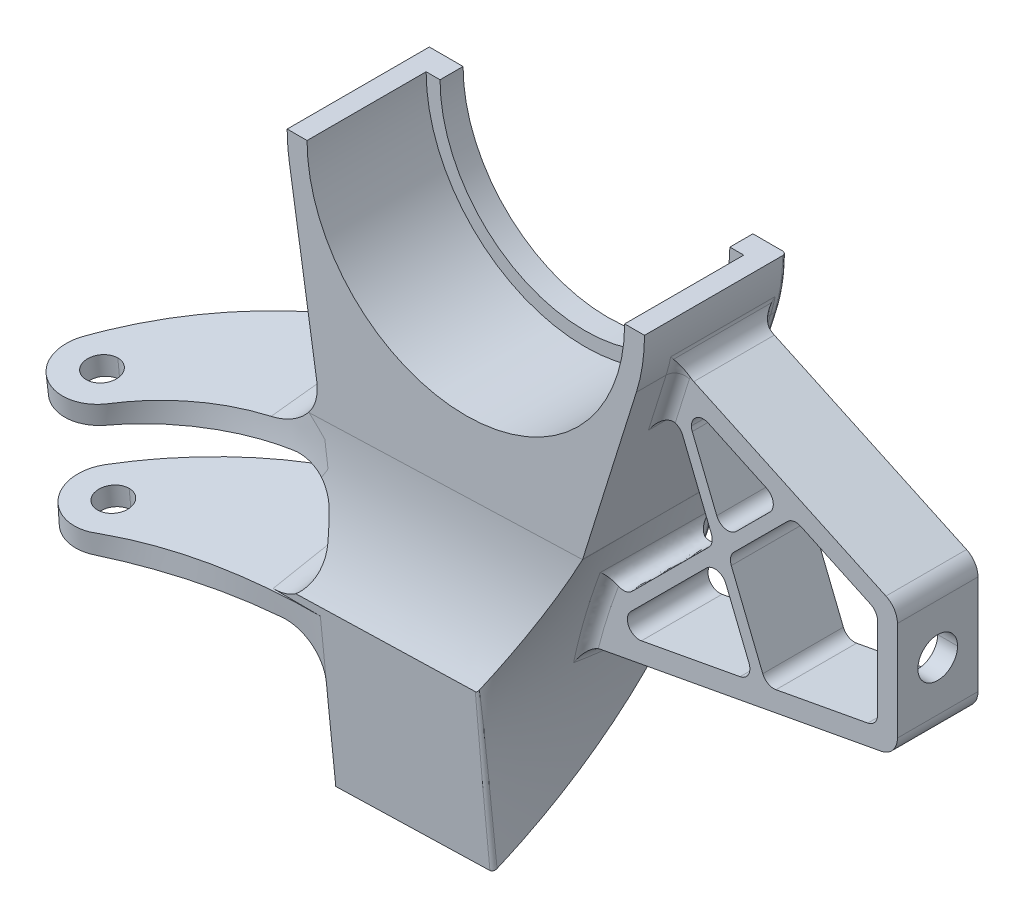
SolidWorks part; units mm, degrees
ref_plane "Ebene vorne" through (0, 0, 0) normal (0, 0, 1) x (1, 0, 0)
ref_plane "Ebene oben" through (0, 0, 0) normal (0, 1, 0) x (1, 0, 0)
ref_plane "Ebene rechts" through (0, 0, 0) normal (1, 0, 0) x (0, 0, -1)
imported_body "Importiert1"
other "Fläche löschen1" [suppressed]
fillet "Verrundung1" [suppressed] radius 30
ref_plane "Ebene1" through (-30.3597, -91.9778, 25.0376) normal (0.1035, -0.0945, 0.9901) x (0.9946, 0.0098, -0.103)
sketch "Skizze1" plane through (-30.3597, -91.9778, 25.0376) normal (0.1035, -0.0945, 0.9901) x (0.9946, 0.0098, -0.103)
  line L0 (-50.7049, 0) -> (0, 0)
  line L1 (-50.7049, 0) -> (0, 0) construction
  line L2 (2.7446, 8.0372) -> (-7.2602, -4.0825)
  arc A0 (-6.9958, -0.6946) -> (-0.1049, 6.8637) centre (-9.9007, 8.8742) ccw construction
  spline S0 degree 3 poles (1699.9889, -889.9636) (21.3325, -654.3805) (17.5656, -326.5526) (-0.0381, 0.7082) (-0.0476, 0.8852) (-17.6849, 328.4814) (-50.0649, 655.1065) (-1702.585, 892.3272) knots -503.335226 -503.335226 -503.335226 -503.335226 0.272589 0.272589 0.545178 0.545178 504.670765 504.670765 504.670765 504.670765 only from (0, 0) to (-0.1049, 1.9484)
  spline S1 degree 3 poles (0, 0) (-0.0095, 0.177) (-0.019, 0.3541) (-0.0381, 0.7082) (-0.0476, 0.8852) (-0.073, 1.3576) (-0.089, 1.653) (-0.1049, 1.9484) knots 0 0 0 0 0.272589 0.272589 0.545178 0.545178 1 1 1 1 construction
  spline S2 degree 3 poles (-1886.469, -621.0381) (2001.1086, 104.5006) (-2015.5402, -16.994) (1875.9916, 652.0051) knots -17.402918 -17.402918 -17.402918 -17.402918 20.424874 20.424874 20.424874 20.424874 only from (-0.1049, 1.9484) to (-4.1842, 25)
  spline S3 degree 3 poles (-0.1049, 1.9484) (-1.122, 9.6877) (-2.5792, 17.3614) (-4.1842, 25) knots 0 0 0 0 1 1 1 1 construction
  dimension "D1" = 10
  dimension "D2" = 3
surface "Oberfläche-Linear austragen1" sketch "Skizze1" parameters "D1"=33.1, "D2"=37.7
other "Fläche ersetzen1"
delete or keep bodies "Körper-Löschen1" type delete bodies bodies 103
fillet "Verrundung3" radius 10 1 edges at (-34.2452, -92.0011, 25.2823)
other "Fläche löschen3"
fillet "Verrundung6" radius 10 1 edges at (-31.006, -87.5296, 23.2494)
sketch "Skizze2" [suppressed] plane through (0, 0, 0) normal (0, 0, -1) x (-1, 0, 0)
  line L0 (8.7548, -110.9323) -> (19.5635, -41.6628)
  line L1 (8.7548, -110.9323) -> (45.0706, -116.599)
  line L2 (19.5635, -41.6628) -> (55.8793, -47.3295)
  line L3 (45.0706, -116.599) -> (55.8793, -47.3295)
  line L4 (44.462, -6.9378) -> (36.3394, -58.9926) construction
  dimension "D1" = 18.8765
  dimension "D2" = 15
  dimension "D3" = 15
extrude "Schnitt-Linear austragen1" [suppressed] cut sketch "Skizze2" against normal through all flip side to cut
sketch3d "3D-Skizze1" [suppressed]
  line L0 (-35.6353, -64.4926, 0.1801) -> (-34.177, -67.948, 36.3964) construction
  line L1 (-35.6353, -64.4926, 0.1801) -> (-34.177, -67.948, 36.3964)
  spline S0 degree 3 poles (-1945.7002, -51.2817, -454.1591) (50.1646, -58.6287, -377.1469) (-44.014, -77.7384, -176.8529) (-30.9602, -96.5352, 20.1612) (-30.7394, -96.8176, 23.1213) (-30.2214, -97.3819, 29.0353) (-29.9255, -97.6638, 31.9899) (-29.3826, -98.0855, 36.4096) (-29.1848, -98.2259, 37.8812) (-19.6136, -104.2289, 100.8003) (31.6775, -109.4405, 155.4245) (1964.085, -85.4365, -96.1608) knots -16.127886 -16.127886 -16.127886 -16.127886 0.25 0.25 0.5 0.5 0.75 0.75 0.875 0.875 6.110281 6.110281 6.110281 6.110281 only from (-31.6783, -95.4044, 8.3089) to (-28.1953, -98.7843, 43.7345) construction
  spline S1 degree 3 poles (-30.0862, 47.6917, -1996.9618) (-38.3515, -2.3603, -592.8146) (-37.8444, -49.4641, -104.7528) (-36.1318, -60.4583, 10.5404) (-36.0286, -61.0236, 16.4644) (-35.8944, -61.5947, 22.4501) (-35.7919, -61.9542, 26.219) (-35.6945, -62.2398, 29.211) (-35.6097, -62.4569, 31.4877) (-33.0861, -68.077, 90.306) (-24.7623, -52.6485, -64.5376) (52.7516, -353.3921, 2012.6508) knots -9.54832 -9.54832 -9.54832 -9.54832 0.130213 0.250002 0.500003 0.625003 0.750004 0.814855 0.875001 0.940263 5.45435 5.45435 5.45435 5.45435 only from (-36.2805, -59.4529, 0.0013) to (-35.401, -62.879, 35.9119) construction
  spline S2 degree 3 poles (-31.6783, -95.4044, 8.3089) (-31.5241, -95.6873, 11.2734) (-31.3528, -95.97, 14.237) (-30.9602, -96.5352, 20.1612) (-30.7394, -96.8176, 23.1213) (-30.2214, -97.3819, 29.0353) (-29.9255, -97.6638, 31.9899) (-29.3826, -98.0855, 36.4096) (-29.1848, -98.2259, 37.8812) (-28.7384, -98.5058, 40.8157) (-28.4913, -98.6455, 42.2791) (-28.1953, -98.7843, 43.7345) knots 0 0 0 0 0.25 0.25 0.5 0.5 0.75 0.75 0.875 0.875 1 1 1 1
  spline S3 degree 3 poles (-36.2805, -59.4529, 0.0013) (-36.2589, -59.614, 1.6904) (-36.2171, -59.9112, 4.8034) (-36.1318, -60.4583, 10.5404) (-36.0286, -61.0236, 16.4644) (-35.8944, -61.5947, 22.4501) (-35.7919, -61.9542, 26.219) (-35.6945, -62.2398, 29.211) (-35.6097, -62.4569, 31.4877) (-35.509, -62.6811, 33.8349) (-35.4367, -62.8169, 35.261) (-35.401, -62.879, 35.9119) knots 0 0 0 0 0.130213 0.250002 0.500003 0.625003 0.750004 0.814855 0.875001 0.940263 1 1 1 1
sketch3d "#3d kein Mittelpunkt!" [suppressed]
  spline S0 degree 3 poles (-36.2805, -59.4529, 0.0013) (-36.2589, -59.614, 1.6904) (-36.2171, -59.9112, 4.8034) (-36.1318, -60.4583, 10.5404) (-36.0286, -61.0236, 16.4644) (-35.8944, -61.5947, 22.4501) (-35.7919, -61.9542, 26.219) (-35.6945, -62.2398, 29.211) (-35.6097, -62.4569, 31.4877) (-35.509, -62.6811, 33.8349) (-35.4367, -62.8169, 35.261) (-35.401, -62.879, 35.9119) knots 0 0 0 0 0.130213 0.250002 0.500003 0.625003 0.750004 0.814855 0.875001 0.940263 1 1 1 1 construction
  point P0 (-36.0232, -61.0218, 16.4454)
ref_plane "Ebene2" [suppressed] through (-36.0232, -61.0218, 16.4454) normal (0.0196, -0.0949, 0.9953) x (0.9998, 0.0019, -0.0195)
sketch "Skizze3" [suppressed] plane through (-36.0232, -61.0218, 16.4454) normal (0.0196, -0.0949, 0.9953) x (0.9998, 0.0019, -0.0195)
  line L0 (-0.3163, 2.0389) -> (-2.5578, 16.4706)
  line L1 (-1.7912, 11.5348) -> (-2.5578, 16.4706) construction
  line L2 (-17.7179, 0) -> (0, 0)
  line L3 (-17.7179, 0) -> (-11.6727, 0) construction
  line L4 (-5.873, 0) -> (-1.1384, 7.3319) construction
  line L5 (-7.6844, -2.8051) -> (0.673, 10.137)
  arc A0 (-11.6727, 0) -> (-1.7912, 11.5348) centre (-11.6727, 10) ccw construction
  spline S0 degree 3 poles (2788.8283, 1011.514) (-2911.5094, -237.37) (2910.8903, 250.641) (-2794.9671, -1000.0417) knots -282.416174 -282.416174 -282.416174 -282.416174 278.127147 278.127147 278.127147 278.127147 only from (-0.3163, 2.0389) to (0, 0)
  spline S1 degree 3 poles (-0.3163, 2.0389) (-0.2105, 1.3593) (-0.105, 0.6797) (0, 0) knots 0 0 0 0 1 1 1 1 construction
  point P11 (-3.5057, 3.6659)
  dimension "D1" = 10
surface "Oberfläche-Linear austragen2" [suppressed] sketch "Skizze3" parameters "D1"=26.4, "D2"=25.8
sketch3d "#Try1~3D-Skizze2"
  line L0 (-89.0409, -63.5732, 43.188) -> (-87.8029, -98.2269, 37.892)
ref_plane "Ebene3" through (-70.4662, -63.3769, 18.3472) normal (0.8743, -0.1258, 0.4688) x (-0.084, -0.9905, -0.109)
sketch3d "3D-Skizze4"
  line L0 (-69.7343, -61.1305, 17.5846) -> (-82.9253, -97.7006, 32.376) construction
  spline S0 degree 3 poles (-87.8029, -98.2269, 37.892) (-86.2573, -98.0437, 35.9724) (-84.6296, -97.8682, 34.1327) (-82.9253, -97.7006, 32.376) knots 0 0 0 0 1 1 1 1 construction
  spline S1 degree 3 poles (-81.369, -92.5332, 30.8595) (-81.451, -92.7878, 30.9441) (-81.6125, -93.294, 31.1096) (-81.8393, -94.019, 31.3382) (-82.0667, -94.7596, 31.5637) (-82.289, -95.4978, 31.7802) (-82.5061, -96.2338, 31.9877) (-82.7232, -96.9843, 32.1911) (-82.8586, -97.4627, 32.3154) (-82.9253, -97.7006, 32.376) knots 0 0 0 0 0.146135 0.291137 0.43503 0.577838 0.719586 0.860299 1 1 1 1 construction
other "Fläche verschieben1" parameters "D1"=0.5
fillet "Verrundung7" radius 10 3 edges at (-30.0629, -97.5201, 30.4843)
other "Fläche verschieben2" parameters "D1"=0.4
other "Fläche löschen4"
other "Fläche löschen5"
